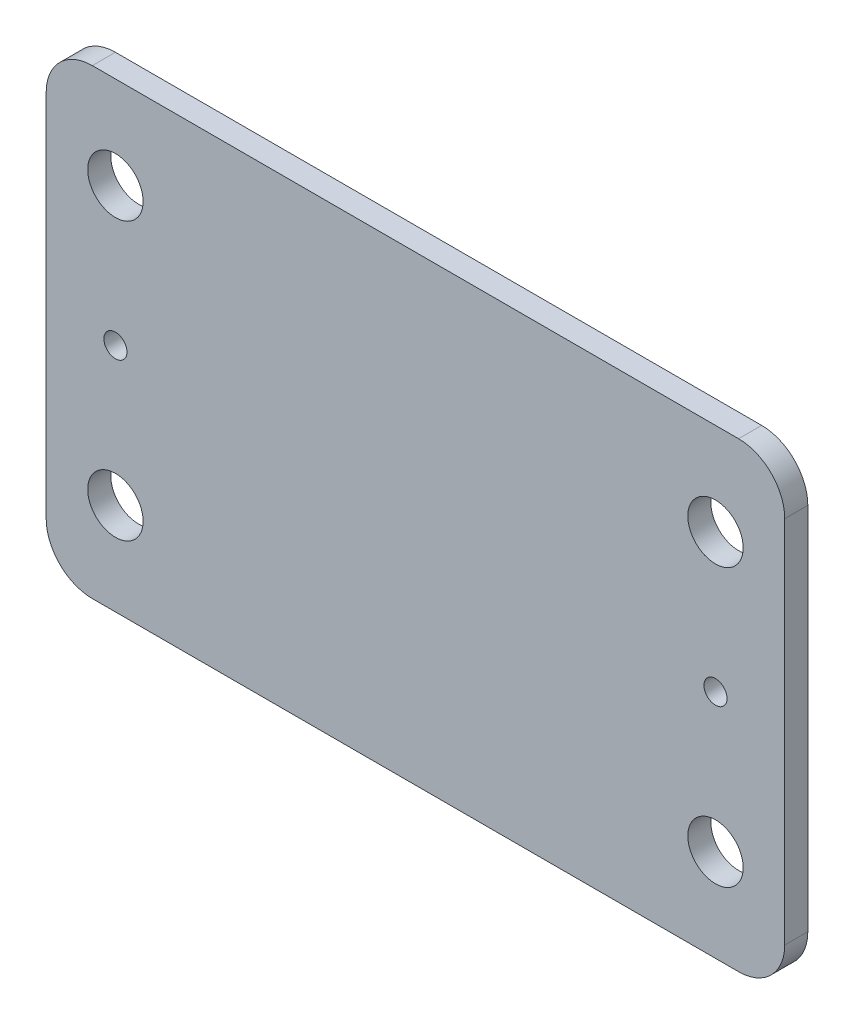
SolidWorks part; units mm, degrees
ref_plane "Plan de face" through (0, 0, 0) normal (0, 0, 1) x (1, 0, 0)
ref_plane "Plan de dessus" through (0, 0, 0) normal (0, 1, 0) x (1, 0, 0)
ref_plane "Plan de droite" through (0, 0, 0) normal (1, 0, 0) x (0, 0, -1)
sketch "Esquisse1" plane through (0, 0, 0) normal (0, 0, 1) x (1, 0, 0)
  line L1 (0, 0) -> (160, 0)
  line L2 (0, 0) -> (0, 100)
  line L3 (0, 100) -> (160, 100)
  line L4 (160, 0) -> (160, 100)
  dimension "D1" = 100
  dimension "D2" = 160
extrude "Boss.-Extru.1" add sketch "Esquisse1" along normal blind 5
sketch "Esquisse2" plane through (0, 0, 5) normal (0, 0, 1) x (1, 0, 0)
  line L0 (160, 100) -> (0, 100) construction
  line L1 (0, 100) -> (0, 0) construction
  line L2 (160, 0) -> (160, 100) construction
  line L3 (0, 0) -> (160, 0) construction
  circle A0 centre (15, 80) radius 6
  circle A1 centre (145, 80) radius 6
  circle A2 centre (15, 20) radius 6
  circle A3 centre (145, 20) radius 6
  dimension "D1" = 20
  dimension "D3" = 12
  dimension "D4" = 12
  dimension "D7" = 12
  dimension "D10" = 15
  dimension "D2" = 15
  dimension "D5" = 20
  dimension "D6" = 15
  dimension "D8" = 15
  dimension "D9" = 20
  dimension "D11" = 20
extrude "Enlèv. mat.-Extru.1" cut sketch "Esquisse2" against normal through all
fillet "Congé1" radius 10 4 edges at (0, 0, 2.5) (160, 0, 2.5) (160, 100, 2.5) (0, 100, 2.5)
sketch "Esquisse3" plane through (0, 0, 5) normal (0, 0, 1) x (1, 0, 0)
  line L0 (0, 90) -> (0, 10) construction
  line L1 (10, 0) -> (150, 0) construction
  line L2 (160, 10) -> (160, 90) construction
  circle A0 centre (15, 50) radius 2.5
  circle A1 centre (145, 50) radius 2.5
  point P2 (0, 50)
  dimension "D1" = 15
  dimension "D3" = 50
  dimension "D2" = 50
  dimension "D4" = 15
extrude "Enlèv. mat.-Extru.2" cut sketch "Esquisse3" against normal through all
